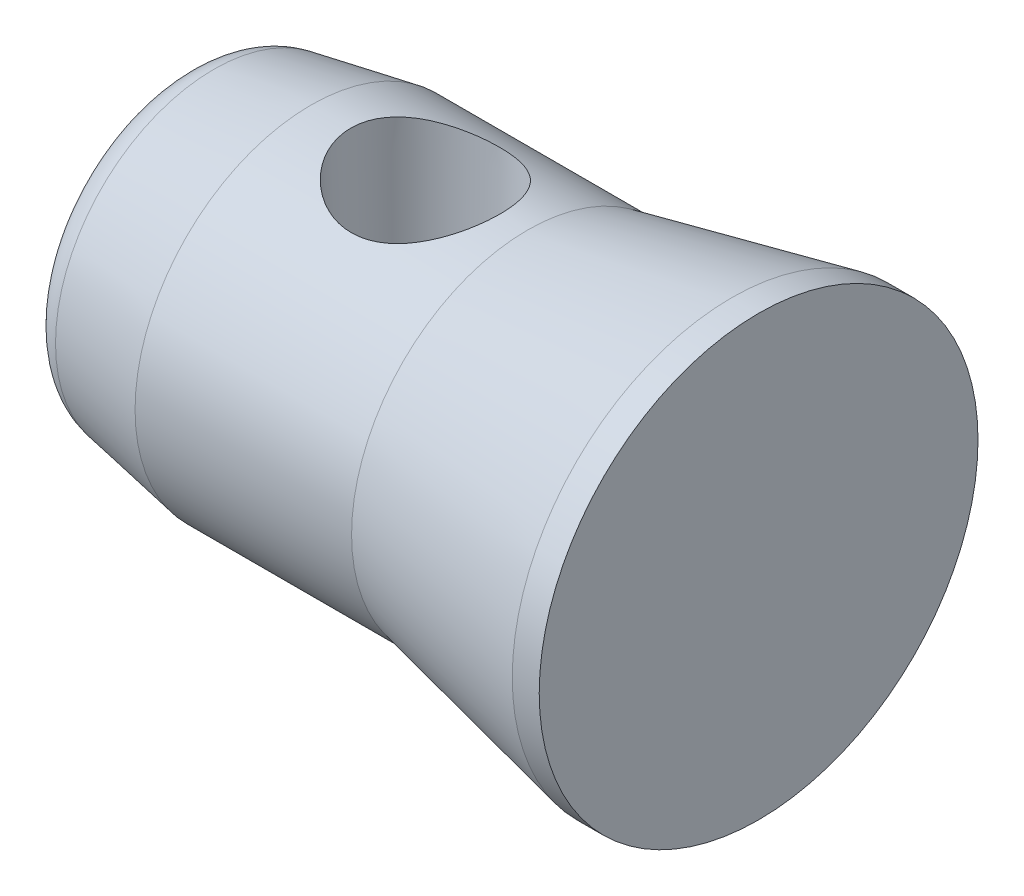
SolidWorks part; units mm, degrees
ref_plane "Plan1" through (0, 0, 0) normal (0, 0, 1) x (1, 0, 0)
ref_plane "Plan2" through (0, 0, 0) normal (0, 1, 0) x (1, 0, 0)
ref_plane "Plan3" through (0, 0, 0) normal (1, 0, 0) x (0, 0, -1)
sketch "Esquisse1" plane through (0, 0, 0) normal (0, 0, 1) x (1, 0, 0)
  line L0 (-110, 0) -> (120, 0) construction
  line L1 (-33.874, 13.903) -> (-16.762, 13.903)
  line L2 (-0.6307, 17.338) -> (1.5, 17.338)
  line L4 (-16.762, 13.903) -> (-0.6307, 17.338)
  line L6 (-44.015, 0) -> (1.5, 0)
  line L7 (-33.874, 13.903) -> (-41.5498, 12.5125)
  line L9 (-44.015, 0) -> (-44.015, 9.5606)
  line L11 (1.5, 17.338) -> (1.5, 0)
  arc A1 (-44.015, 9.5606) -> (-41.5498, 12.5125) centre (-41.015, 9.5606) cw
  dimension "D1" = 17.338
  dimension "D2" = 13.903
  dimension "D4" = 16.762
  dimension "D6" = 33.874
  dimension "D8" = 1.5
  dimension "D10" = 169.732
revolve "Base-Révolution" add sketch "Esquisse1" angle 360 about L0
sketch "Esquisse2" plane through (0, 0, 0) normal (0, 0, 1) x (1, 0, 0)
  line L0 (-2.17, 0) -> (-47.5, 0) construction
  line L1 (-110, 0) -> (120, 0) construction
  line L2 (-29.7546, -19.5) -> (-30.9039, 20)
  line L3 (-24.835, 22.7495) -> (-24.835, -24.2754) construction
  line L4 (-30.9039, 20) -> (-24.835, 20)
  line L5 (-29.7546, -19.5) -> (-24.835, -19.5)
  line L6 (-24.835, 20) -> (-24.835, -19.5)
revolve "Enlèvement de matière-Révolution1" cut sketch "Esquisse2" angle 360 about L3
